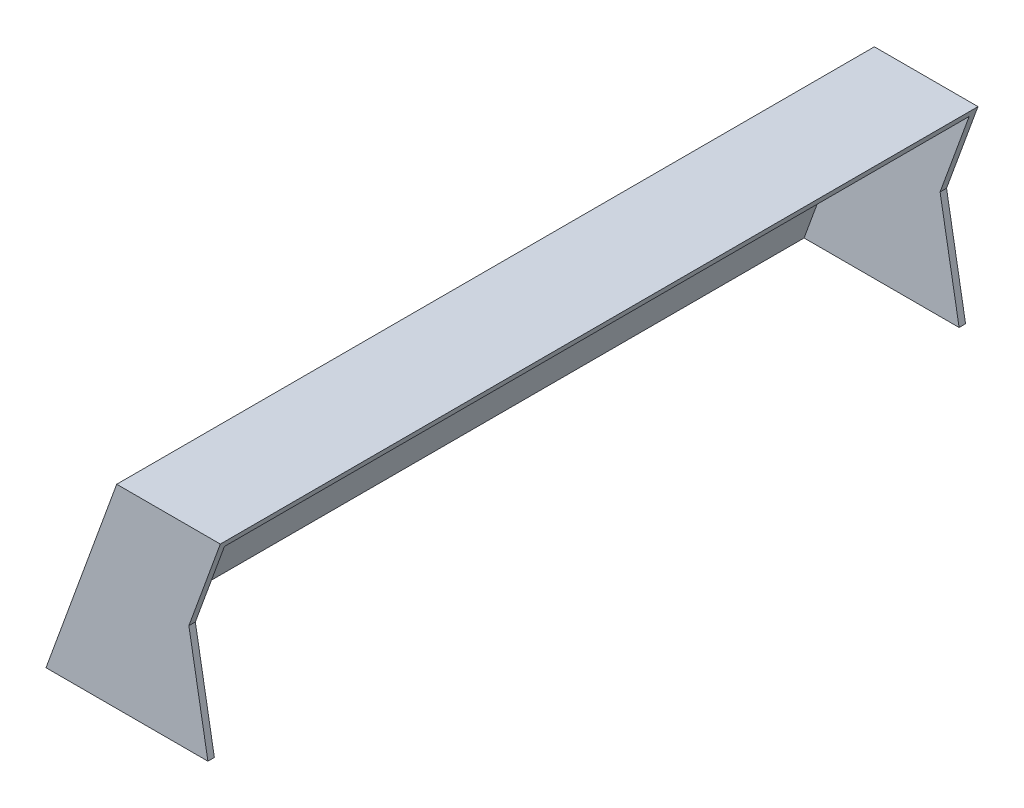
SolidWorks part; units mm, degrees
ref_plane "Front Plane" through (0, 0, 0) normal (0, 0, 1) x (1, 0, 0)
ref_plane "Top Plane" through (0, 0, 0) normal (0, 1, 0) x (1, 0, 0)
ref_plane "Right Plane" through (0, 0, 0) normal (1, 0, 0) x (0, 0, -1)
sketch "Sketch1" plane through (0, 0, 0) normal (0, 0, 1) x (1, 0, 0)
  line L0 (0, 0) -> (250, 0)
  line L1 (0, 0) -> (109.1911, 300)
  line L2 (109.1911, 300) -> (269.1911, 300)
  line L3 (269.1911, 300) -> (220.6283, 166.575)
  line L4 (220.6283, 166.575) -> (250, 0)
  dimension "D1" = 250
  dimension "D2" = 300
  dimension "D3" = 160
  dimension "D4" = 70
  dimension "D5" = 80
extrude "Boss-Extrude1" add sketch "Sketch1" along normal blind 1170
shell "Shell1" thickness 10
sketch "Sketch2" plane through (0, 0, 0) normal (-0.9397, 0.342, 0) x (0, 0, 1)
  line L0 (585, 319.2533) -> (585, 0) construction
  line L1 (1170, 319.2533) -> (0, 319.2533) construction
  line L2 (1170, 0) -> (0, 0) construction
  line L3 (1050, 219.2533) -> (1050, 144.2533) construction
  line L4 (1110, 219.2533) -> (1110, 144.2533)
  line L5 (990, 219.2533) -> (990, 144.2533)
  line L6 (1170, 319.2533) -> (1170, 0) construction
  line L7 (120, 219.2533) -> (120, 144.2533) construction
  line L8 (60, 219.2533) -> (60, 144.2533)
  line L9 (180, 219.2533) -> (180, 144.2533)
  arc A0 (1110, 219.2533) -> (990, 219.2533) centre (1050, 219.2533) ccw
  arc A1 (990, 144.2533) -> (1110, 144.2533) centre (1050, 144.2533) ccw
  arc A2 (60, 219.2533) -> (180, 219.2533) centre (120, 219.2533) cw
  arc A3 (180, 144.2533) -> (60, 144.2533) centre (120, 144.2533) cw
  point P8 (1050, 181.7533)
  point P17 (120, 181.7533)
  dimension "D1" = 60
  dimension "D2" = 75
  dimension "D3" = 60
  dimension "D4" = 100
extrude "Cut-Extrude1" cut sketch "Sketch2" against normal up to next
